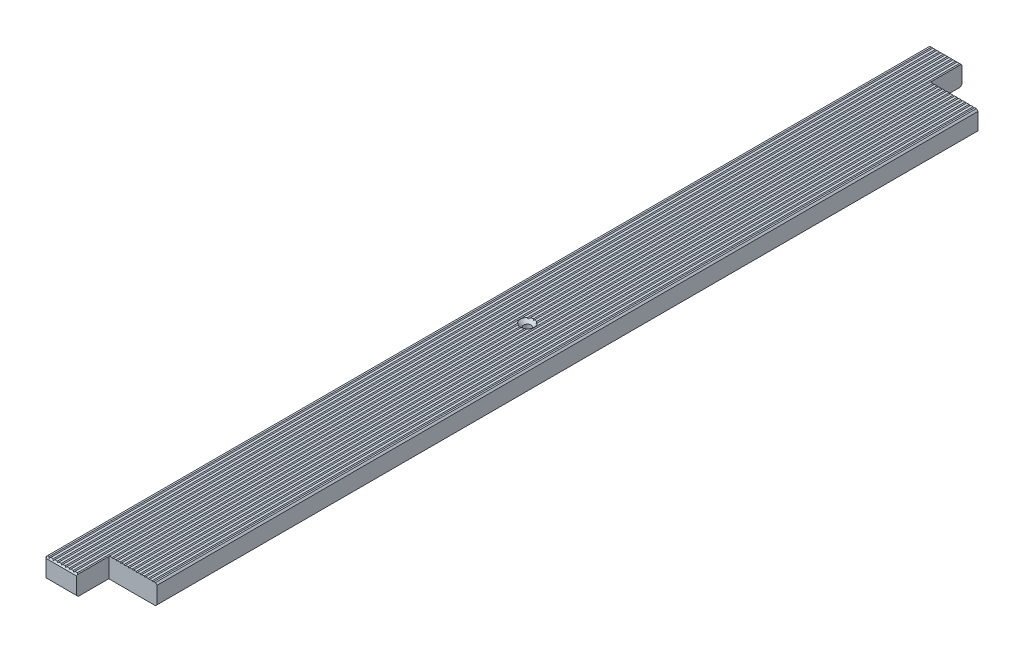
SolidWorks part; units mm, degrees
ref_plane "Plan de face" through (0, 0, 0) normal (0, 0, 1) x (1, 0, 0)
ref_plane "Plan de dessus" through (0, 0, 0) normal (0, 1, 0) x (1, 0, 0)
ref_plane "Plan de droite" through (0, 0, 0) normal (1, 0, 0) x (0, 0, -1)
sketch "Esquisse1" plane through (0, 0, 0) normal (0, 0, 1) x (1, 0, 0)
  line L0 (50, -12.5) -> (-50, 12.5) construction
  line L2 (50, -12.5) -> (-50, -12.5)
  line L3 (50, -12.5) -> (50, 12.5)
  line L4 (50, 12.5) -> (-50, 12.5)
  line L5 (-50, -12.5) -> (-50, 12.5)
  dimension "D1" = 25
  dimension "D2" = 100
extrude "Boss.-Extru.1" add sketch "Esquisse1" along normal mid plane 1100
chamfer "Chanfrein1" distance 2 angle 45 12 edges at (-50, 0, -550) (50, 0, -550) (-50, -12.5, 0) (0, -12.5, -550) (50, -12.5, 0) (0, -12.5, 550) (-50, 0, 550) (50, 0, 550) (50, 12.5, 0) (0, 12.5, 550) (-50, 12.5, 0) (0, 12.5, -550)
sketch "Esquisse2" plane through (0, 0, 550) normal (0, 0, 1) x (1, 0, 0)
  line L0 (-45, 25.2323) -> (-45, -21.4574) construction
  line L1 (-48, 12.5) -> (48, 12.5) construction
  line L2 (-46, 12.5) -> (-44, 12.5)
  line L3 (-46, 12.5) -> (-45, 11.5)
  line L4 (-45, 11.5) -> (-44, 12.5)
  dimension "D1" = 90
  dimension "D2" = 1
  dimension "D3" = 45
extrude "Enlèv. mat.-Extru.1" cut sketch "Esquisse2" against normal through all
pattern_linear "Répétition linéaire1" count 19 spacing 5 along (1, 0, 0) of "Enlèv. mat.-Extru.1"
hole_wizard "Fraisage pour vis à tête fraisée M81" positions "Esquisse4" profile "Esquisse3" countersink size "M8" standard "ISO"
sketch "Esquisse4" plane through (0, 12.5, 0) normal (0, 1, 0) x (-1, 0, 0)
  line L0 (48, -550) -> (-48, -550) construction
  line L2 (0, -598.1763) -> (0, 635.096) construction
  line L3 (0, -549) -> (0, 549) construction
  line L6 (-48, 550) -> (48, 550) construction
  point P0 (0, -520)
  point P19 (0, 0)
  point P21 (0, 520)
  dimension "D1" = 30
  dimension "D2" = 30
sketch "Esquisse3" plane through (0, 12.5, -520) normal (1, 0, 0) x (0, 0, 1)
  line L0 (0, 0) -> (0, 25)
  line L1 (0, 25) -> (4.5, 25)
  line L2 (4.5, 25) -> (4.5, 4.15)
  line L3 (4.5, 4.15) -> (8.65, 0)
  line L5 (8.65, 0) -> (0, 0)
  line L6 (-4.5, 4.15) -> (-8.65, 0) construction
  line L11 (0, -6.35) -> (0, 107.95) construction
  dimension "Diamètre du perçage jusqu'au prochain" = 9
  dimension "Profondeur du perçage jusqu'au prochain" = 25
  dimension "Diamètre du fraisage entrant" = 17.3
  dimension "Angle du fraisage entrant" = 90
sketch "Esquisse5" plane through (0, 12.5, 0) normal (0, 1, 0) x (1, 0, 0)
  line L0 (50, 548) -> (50, -548) construction
  line L1 (50, -510) -> (-10, -510)
  line L2 (50, -510) -> (50, -550)
  line L3 (50, -550) -> (-10, -550)
  line L4 (-10, -510) -> (-10, -550)
  line L5 (48, -550) -> (-48, -550) construction
  line L6 (-48, 550) -> (48, 550) construction
  line L7 (50, 510) -> (-10, 510)
  line L8 (50, 510) -> (50, 550)
  line L9 (50, 550) -> (-10, 550)
  line L10 (-10, 510) -> (-10, 550)
  dimension "D1" = 40
  dimension "D2" = 60
  dimension "D3" = 40
  dimension "D4" = 60
extrude "Enlèv. mat.-Extru.2" cut sketch "Esquisse5" against normal through all
